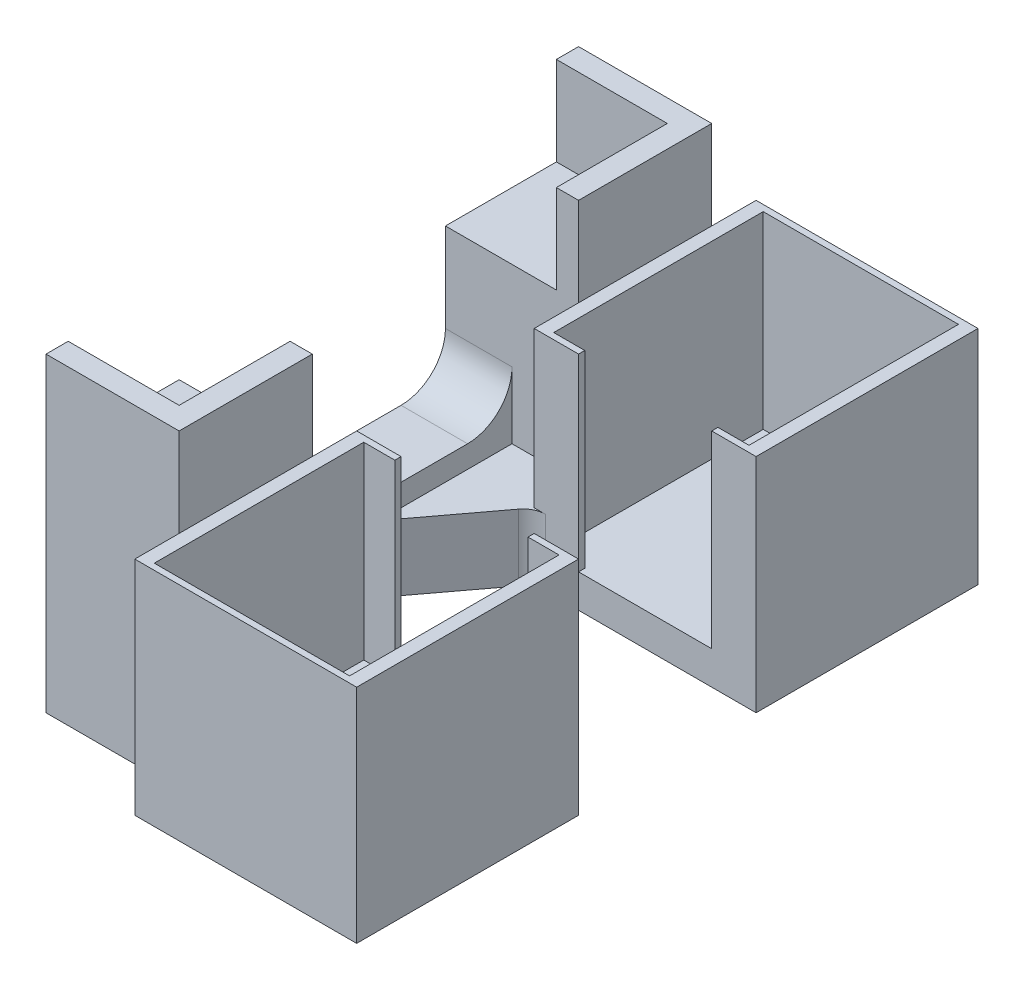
SolidWorks part; units mm, degrees
ref_plane "Alzado" through (0, 0, 0) normal (0, 0, 1) x (1, 0, 0)
ref_plane "Planta" through (0, 0, 0) normal (0, 1, 0) x (1, 0, 0)
ref_plane "Vista lateral" through (0, 0, 0) normal (1, 0, 0) x (0, 0, -1)
sketch "Croquis1" plane through (0, 0, 0) normal (0, 0, 1) x (1, 0, 0)
  line L1 (-25, -25) -> (25, -25)
  line L2 (-25, -25) -> (-25, 25)
  line L3 (-25, 25) -> (25, 25)
  line L4 (25, -25) -> (25, 25)
  line L5 (-25, -25) -> (25, 25) construction
  line L6 (-25, 25) -> (25, -25) construction
  point P0 (0, 0)
  dimension "D1" = 50
  dimension "D2" = 50
extrude "Saliente-Extruir1" add sketch "Croquis1" along normal blind 50
sketch "Croquis2" plane through (0, 25, 0) normal (0, 1, 0) x (1, 0, 0)
  line L0 (0, -25) -> (0, 0) construction
  line L1 (-22, -48.6) -> (-15, -48.6)
  line L2 (-22, -48.6) -> (-22, -1.4)
  line L3 (-22, -1.4) -> (22, -1.4)
  line L4 (22, -48.6) -> (22, -1.4)
  line L5 (-22, -48.6) -> (22, -1.4) construction
  line L6 (-22, -1.4) -> (22, -48.6) construction
  line L7 (-25, -25) -> (0, -25) construction
  line L8 (-25, -50) -> (-25, 0) construction
  line L9 (25, -50) -> (-25, -50) construction
  line L11 (-15, -48.6) -> (-15, -50)
  line L12 (-15, -50) -> (15, -50)
  line L13 (15, -48.6) -> (15, -50)
  line L14 (15, -48.6) -> (22, -48.6)
  point P0 (0, -25)
  dimension "D1" = 44
  dimension "D2" = 47.2
  dimension "D3" = 30
extrude "Cortar-Extruir1" cut sketch "Croquis2" against normal blind 42.5 contours L2 L3 L4 L14 L13 L12 L11 L1
sketch "Croquis5" plane through (-25, 0, 0) normal (-1, 0, 0) x (0, 0, 1)
  line L0 (25, 25) -> (25, -25) construction
  line L1 (50, 25) -> (0, 25) construction
  line L2 (50, -25) -> (0, -25) construction
  line L4 (10, 25) -> (40, 25)
  line L5 (10, 25) -> (10, -25)
  line L6 (10, -25) -> (40, -25)
  line L7 (40, 25) -> (40, -25)
  dimension "D1" = 30
extrude "Saliente-Extruir3" add sketch "Croquis5" along normal blind 30
sketch "Croquis6" plane through (0, -25, 0) normal (0, -1, 0) x (1, 0, 0)
  line L0 (-40, 40) -> (-40, 10) construction
  line L1 (-50, 35) -> (-30, 35)
  line L2 (-50, 35) -> (-50, 15)
  line L3 (-50, 15) -> (-30, 15)
  line L4 (-30, 35) -> (-30, 15)
  line L5 (-55, 40) -> (-25, 40) construction
  line L6 (-55, 10) -> (-25, 10) construction
  line L7 (-55, 25) -> (25, 25) construction
  line L8 (-55, 10) -> (-55, 40) construction
  line L9 (25, 50) -> (25, 0) construction
  dimension "D1" = 20
  dimension "D2" = 20
extrude "Cortar-Extruir3" cut sketch "Croquis6" against normal offset from surface (45 mm away) 5 contours L1 L4 L3 L2
sketch "Croquis7" plane through (-55, 0, 0) normal (-1, 0, 0) x (0, 0, 1)
  line L1 (40, -25) -> (70, -25)
  line L2 (40, -25) -> (40, -10)
  line L3 (40, -10) -> (70, -10)
  line L4 (70, -25) -> (70, -10)
  dimension "D1" = 30
  dimension "D2" = 15
extrude "Saliente-Extruir4" add sketch "Croquis7" against normal blind 15
sketch "Croquis8" plane through (-55, 0, 0) normal (-1, 0, 0) x (0, 0, 1)
  line L1 (40, -25) -> (40, 25) construction
  line L2 (10, -25) -> (70, -25) construction
  circle A0 centre (62.2, -15) radius 4.05
  dimension "D1" = 8.1
  dimension "D2" = 22.2
  dimension "D3" = 10
extrude "Cortar-Extruir4" cut sketch "Croquis8" against normal blind 10
sketch "Croquis9" plane through (0, -10, 0) normal (0, 1, 0) x (1, 0, 0)
  line L1 (-55, -40) -> (-40, -40)
  line L2 (-55, -40) -> (-55, -70)
  line L3 (-55, -70) -> (-40, -70)
  line L4 (-40, -40) -> (-40, -70)
extrude "Saliente-Extruir5" add sketch "Croquis9" along normal blind 5
fillet "Redondeo2" radius 10 1 edges at (-47.5, -5, 40)
fillet "Redondeo3" radius 2 1 edges at (-55, -15, 70)
sketch "Croquis10" plane through (0, -5, 0) normal (0, 1, 0) x (1, 0, 0)
  line L0 (-40, -70) -> (-25, -50)
  line L1 (-25, -50) -> (-25, -40)
  line L2 (-25, -40) -> (-40, -40)
  line L3 (-40, -40) -> (-40, -70)
extrude "Saliente-Extruir6" add sketch "Croquis10" against normal up to surface (15 mm away) from offset 5
fillet "Redondeo4" radius 5 1 edges at (-25, -17.5, 50)
sketch "Croquis11" plane through (0, 25, 0) normal (0, 1, 0) x (1, 0, 0)
  line L0 (-25, -10) -> (-25, -40)
  line L5 (-55, -10) -> (-25, -10) construction
  line L7 (-55, -10) -> (-25, -10)
  line L9 (-25, -40) -> (-30, -40)
  line L10 (-25, -40) -> (-40, -40) construction
  line L11 (-30, -40) -> (-30, -15)
  line L12 (-30, -15) -> (-55, -15)
  line L13 (-55, -40) -> (-55, -10) construction
  line L14 (-55, -15) -> (-55, -10)
  dimension "D1" = 5
  dimension "D2" = 5
extrude "Saliente-Extruir7" add sketch "Croquis11" along normal blind 20
mirror "Simetría1" about plane through (-40, -25, 70) normal (0, 0, 1)
